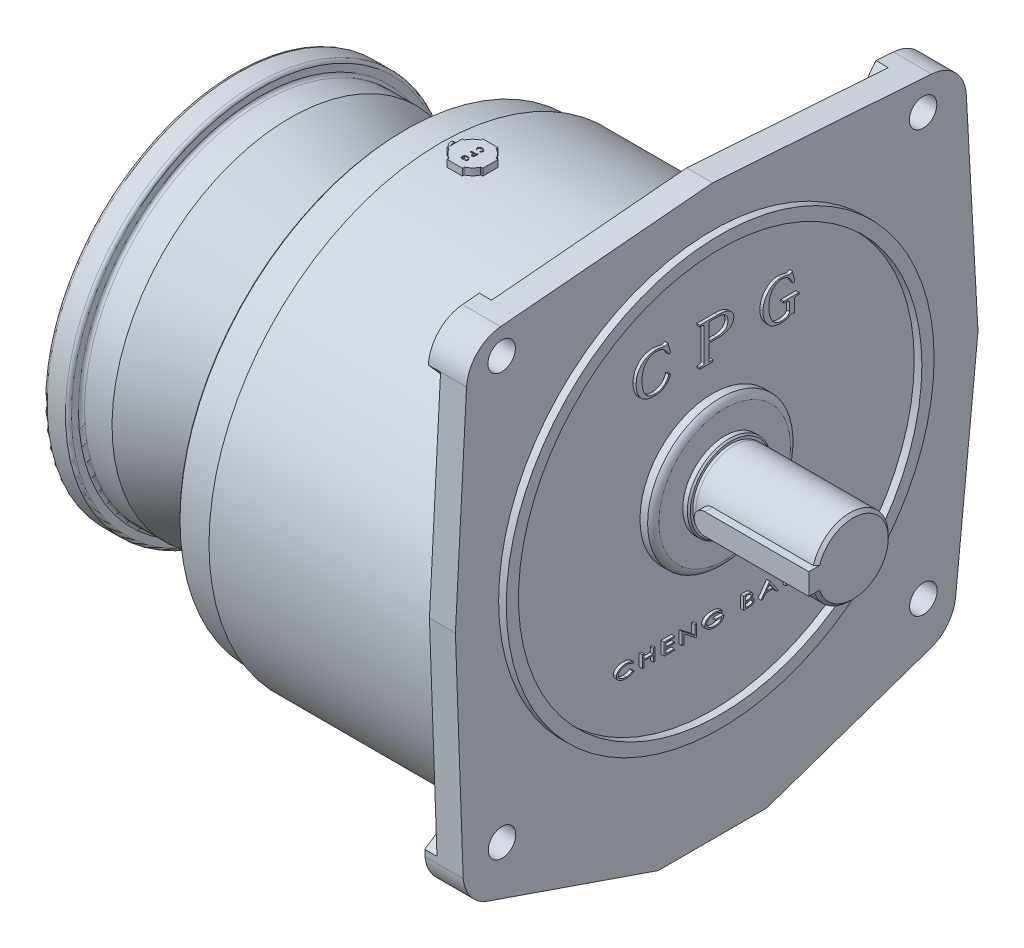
SolidWorks part; units mm, degrees
ref_plane "前基準面" through (0, 0, 0) normal (0, 0, 1) x (1, 0, 0)
ref_plane "上基準面" through (0, 0, 0) normal (0, 1, 0) x (1, 0, 0)
ref_plane "右基準面" through (0, 0, 0) normal (1, 0, 0) x (0, 0, -1)
sketch "草圖2" plane through (0, 0, 0) normal (0, 0, 1) x (1, 0, 0)
  line L0 (-161, 151.5439) -> (0, 151.5439)
  line L1 (-161, 151.5439) -> (-161, 146.5067)
  line L2 (-190.5, 0) -> (0, 0)
  line L3 (0, 0) -> (0, 151.5439)
  line L4 (-162, 147.5067) -> (-161, 146.5067)
  line L5 (-185, 146.5067) -> (-185, 124.0067)
  line L6 (-189, 123.0067) -> (-189, 105.0067)
  line L7 (-190.5, 104.0067) -> (-190.5, 0)
  line L9 (-189, 105.0067) -> (-189.5, 105.0067)
  line L10 (-189.5, 105.0067) -> (-190.5, 104.0067)
  line L12 (-188, 124.0067) -> (-189, 123.0067)
  line L13 (-185, 124.0067) -> (-188, 124.0067)
  line L14 (-184, 147.5067) -> (-185, 146.5067)
  line L15 (-162, 147.5067) -> (-184, 147.5067)
  line L23 (-511.9929, 0) -> (96.9678, 0) construction
  dimension "D4" = 161
revolve "旋轉1" add sketch "草圖2" angle 360 about L23
sketch "草圖5" plane through (0, 0, 0) normal (1, 0, 0) x (0, 0, -1)
  line L0 (-260.2741, 51) -> (337.3159, 51) construction
  line L1 (166.0988, 184.8249) -> (173.7337, 46.8699)
  line L2 (-168.2663, 46.8699) -> (-163.1792, -94.766)
  line L3 (173.7337, 46.8699) -> (159.0195, -97.1828)
  line L4 (0, 0) -> (0, -245.4677) construction
  line L5 (0, 217.8699) -> (-138.6589, 205.7388)
  line L6 (-168.2663, 46.8699) -> (-160.9885, 182.6434)
  line L7 (0, 51) -> (-138, 188.7716) construction
  line L8 (0, 217.8699) -> (143.3342, 207.9121)
  line L9 (-286.7543, 0) -> (309.9532, 0) construction
  line L10 (0, 251.9137) -> (0, 51) construction
  line L14 (35.5, -154.1301) -> (-35.5, -154.1301)
  line L15 (-146.7463, -115.8249) -> (-35.5, -154.1301)
  line L16 (142.6964, -117.2194) -> (35.5, -154.1301)
  circle A0 centre (-138, 188.7716) radius 9
  circle A1 centre (0, 51) radius 195 construction
  circle A2 centre (137.7716, 189) radius 9
  circle A3 centre (138, -86.7716) radius 9
  circle A4 centre (-137.7716, -87) radius 9
  arc A5 (-138.6589, 205.7388) -> (-160.9885, 182.6434) centre (-136.5236, 181.332) ccw
  arc A6 (-163.1792, -94.766) -> (-146.7463, -115.8249) centre (-138.7699, -92.6597) ccw
  arc A7 (159.0195, -97.1828) -> (142.6964, -117.2194) centre (134.72, -94.0542) cw
  arc A8 (143.3342, 207.9121) -> (166.0988, 184.8249) centre (141.6362, 183.471) cw
  dimension "D4" = 18
  dimension "D5" = 24.5
  dimension "D3" = 390
  dimension "D2" = 342
  dimension "D9" = 372
  dimension "D11" = 138
extrude "伸長1" add sketch "草圖5" along normal blind 17
sketch "草圖6" plane through (17, 0, 0) normal (1, 0, 0) x (0, 0, -1)
  circle A0 centre (0, 51) radius 140
  circle A1 centre (0, 51) radius 132
  dimension "D1" = 280
  dimension "D2" = 264
extrude "伸長2" add sketch "草圖6" along normal blind 5
sketch "草圖7" plane through (0, 0, 0) normal (0, 0, 1) x (1, 0, 0)
  line L0 (109, 51) -> (130.8468, 51) construction
  line L1 (31, 76) -> (106.985, 76)
  line L2 (106.985, 76) -> (31, 76)
  line L3 (22, 98.5) -> (17, 98.5)
  line L4 (29, 75.9) -> (29, 77.5)
  line L5 (31, 75.9) -> (31, 76)
  line L6 (24.985, 94.0279) -> (24.985, 78.5)
  line L7 (29, 75.9) -> (31, 75.9)
  line L8 (31, 75.9) -> (29, 75.9)
  line L9 (29, 77.5) -> (29, 75.9)
  line L10 (28, 78.5) -> (29, 77.5)
  line L11 (24.985, 78.5) -> (28, 78.5)
  line L12 (29, 77.5) -> (28, 78.5)
  line L13 (28, 78.5) -> (24.985, 78.5)
  line L14 (31, 75.9) -> (31, 76)
  line L15 (109, 51) -> (109, 74)
  line L16 (106.985, 76) -> (109, 74)
  line L17 (109, 74) -> (106.985, 76)
  line L18 (17, 46.8699) -> (17, 182.6434) construction
  line L20 (17, 98.5) -> (17, 51)
  line L22 (17, 51) -> (109, 51)
  line L23 (17, 217.8699) -> (17, 207.9121) construction
  arc A0 (24.985, 94.0279) -> (22, 98.5) centre (17.9603, 92.5714) ccw
  dimension "D1" = 50
  dimension "D2" = 80
  dimension "D3" = 92
  dimension "D4" = 55
revolve "旋轉2" add sketch "草圖7" angle 360 about L0
sketch "草圖12"
extrude "伸長7" add sketch "草圖12" along normal blind 2
sketch "草圖13" plane through (0, 0, 0) normal (-1, 0, 0) x (0, 0, 1)
  line L0 (-166.0988, 184.8249) -> (-101.3929, 112.628)
  line L1 (-131.988, 208.7004) -> (-71.876, 133.4144)
  line L2 (0, 217.8699) -> (-143.3342, 207.9121) construction
  line L3 (160.9885, 182.6434) -> (100.3002, 113.6021)
  line L4 (127.6635, 206.7008) -> (69.5334, 134.6502)
  line L5 (0, 217.8699) -> (138.6589, 205.7388) construction
  line L6 (-142.6964, -117.2194) -> (-117.0566, -96.2461)
  line L7 (-160.0698, -86.8998) -> (-135.1585, -68.5401)
  line L8 (-173.7337, 46.8699) -> (-159.0195, -97.1828) construction
  line L9 (146.7463, -115.8249) -> (117.0566, -96.2461)
  line L10 (163.3273, -90.6426) -> (134.0214, -70.7377)
  line L12 (168.2663, 46.8699) -> (163.1792, -94.766) construction
  line L13 (163.3273, -90.6426) -> (163.1792, -94.766)
  line L14 (-160.0698, -86.8998) -> (-159.0195, -97.1828)
  line L15 (-131.988, 208.7004) -> (-143.3342, 207.9121)
  line L16 (127.6635, 206.7008) -> (138.6589, 205.7388)
  circle A0 centre (0, 0) radius 151.5439 construction
  circle A1 centre (0, 0) radius 151.5439 construction
  arc A2 (146.7463, -115.8249) -> (163.1792, -94.766) centre (138.7699, -92.6597) ccw construction
  arc A3 (-159.0195, -97.1828) -> (-142.6964, -117.2194) centre (-134.72, -94.0542) ccw construction
  arc A4 (146.7463, -115.8249) -> (163.1792, -94.766) centre (138.7699, -92.6597) ccw
  arc A5 (-159.0195, -97.1828) -> (-142.6964, -117.2194) centre (-134.72, -94.0542) ccw
  arc A6 (-143.3342, 207.9121) -> (-166.0988, 184.8249) centre (-141.6362, 183.471) ccw construction
  arc A7 (160.9885, 182.6434) -> (138.6589, 205.7388) centre (136.5236, 181.332) ccw construction
  arc A8 (-143.3342, 207.9121) -> (-166.0988, 184.8249) centre (-141.6362, 183.471) ccw
  arc A9 (160.9885, 182.6434) -> (138.6589, 205.7388) centre (136.5236, 181.332) ccw
  arc A10 (117.0566, -96.2461) -> (134.0214, -70.7377) centre (0, 0) ccw
  arc A11 (100.3002, 113.6021) -> (69.5334, 134.6502) centre (0, 0) ccw
  arc A12 (-71.876, 133.4144) -> (-101.3929, 112.628) centre (0, 0) ccw
  arc A13 (-135.1585, -68.5401) -> (-117.0566, -96.2461) centre (0, 0) ccw
  circle A17 centre (-137.7716, 189) radius 9 construction
  circle A18 centre (-137.7716, 189) radius 9
  circle A19 centre (138, 188.7716) radius 9 construction
  circle A21 centre (138, 188.7716) radius 9
  circle A22 centre (-138, -86.7716) radius 9 construction
  circle A23 centre (-138, -86.7716) radius 9
  circle A24 centre (137.7716, -87) radius 9 construction
  circle A25 centre (137.7716, -87) radius 9
extrude "伸長13" add sketch "草圖13" along normal blind 8
sketch "草圖14" plane through (0, 0, 0) normal (0, 0, 1) x (1, 0, 0)
  line L0 (-277.5, -116.5) -> (-259.5, -116.5)
  line L1 (-192.5, -91) -> (-205, -91)
  line L2 (-205.5, -91) -> (-259.5, -116.5)
  line L3 (-283, -32.5) -> (-284.5, -32.5)
  line L4 (-321.5954, 0) -> (-95.099, 0) construction
  line L5 (-205, -91) -> (-205.5, -91)
  line L6 (-190.5, 0) -> (-283, 0)
  line L7 (109, 28) -> (109, 74) construction
  line L8 (-190.5, -89) -> (-190.5, 0)
  line L14 (-284.5, -49.0465) -> (-284.5, -32.5)
  line L15 (-245.1, -59.9307) -> (-282.9286, -51)
  line L16 (-290.5, -90) -> (-290.5, -78)
  line L18 (-279.5, -123) -> (-279.5, -118.5)
  line L19 (-293.5, -125) -> (-281.5, -125)
  line L20 (-295.5, -123) -> (-295.5, -90)
  line L21 (-245.1, -71.9894) -> (-245.1, -59.9307)
  line L22 (-290.5, -78) -> (-251.1, -78)
  line L23 (-295.5, -90) -> (-290.5, -90)
  line L24 (-283, -32.5) -> (-283, 0)
  arc A7 (-245.1, -71.9894) -> (-251.1, -78) centre (-251.1, -72) cw
  arc A8 (-190.5, -89) -> (-192.5, -91) centre (-192.5, -89) cw
  arc A9 (-279.5, -118.5) -> (-277.5, -116.5) centre (-277.5, -118.5) cw
  arc A10 (-279.5, -123) -> (-281.5, -125) centre (-281.5, -123) cw
  arc A11 (-293.5, -125) -> (-295.5, -123) centre (-293.5, -123) cw
  arc A13 (-282.9286, -51) -> (-284.5, -49.0465) centre (-282.5, -49.0465) cw
  dimension "D1" = 250
  dimension "D2" = 180
  dimension "D3" = 299.5
  dimension "D4" = 404.5
  dimension "D9" = 105
  dimension "D14" = 51
revolve "旋轉3" add sketch "草圖14" angle 360 about L4
sketch "草圖15" plane through (-295.5, 0, 0) normal (-1, 0, 0) x (0, 0, 1)
  circle A0 centre (0, 0) radius 107.5 construction
  circle A1 centre (-76.014, 76.014) radius 6
  circle A2 centre (76.014, 76.014) radius 6
  circle A3 centre (76.014, -76.014) radius 6
  circle A4 centre (-76.014, -76.014) radius 6
  dimension "D1" = 215
  dimension "D2" = 12
extrude "伸長14" cut sketch "草圖15" against normal blind 30
sketch "草圖16" plane through (-295.5, 0, 0) normal (-1, 0, 0) x (0, 0, 1)
  line L3 (-88.9775, 50.7937) -> (-60.901, 22.7172)
  line L6 (50.7937, 88.9775) -> (22.7172, 60.901)
  line L8 (88.9775, -50.7937) -> (60.901, -22.7172)
  line L11 (-50.7937, -88.9775) -> (-22.7172, -60.901)
  line L13 (-60.901, -22.7172) -> (-88.9775, -50.7937)
  line L16 (-67.8928, -38.7361) -> (-58.167, -29.0104)
  line L18 (41.2181, -70.3748) -> (29.0104, -58.167)
  line L24 (70.3748, -41.2181) -> (58.5646, -28.1991)
  line L36 (41.2181, 70.3748) -> (29.0104, 58.167)
  line L37 (-70.3748, 41.2181) -> (-58.167, 29.0104)
  line L38 (22.7172, -60.901) -> (50.7937, -88.9775)
  line L39 (60.901, 22.7172) -> (88.9775, 50.7937)
  line L40 (-29.0206, 58.1619) -> (-39.7711, 68.9869)
  line L41 (-38.7361, -67.8928) -> (-29.0104, -58.167)
  line L42 (-22.7172, 60.901) -> (-50.7937, 88.9775)
  line L43 (70.3748, 41.2181) -> (58.167, 29.0104)
  arc A13 (75.6403, 48.7703) -> (70.3748, 41.2181) centre (43.6427, 65.4682) cw
  arc A14 (75.6403, 48.7703) -> (48.7703, 75.6403) centre (41.5234, 41.5234) ccw
  arc A15 (-88.9775, -50.7937) -> (-92.1469, -50.3383) centre (-90.3917, -49.3795) cw
  arc A16 (50.7937, 88.9775) -> (50.3383, 92.1469) centre (49.3795, 90.3917) ccw
  arc A17 (-48.7703, 75.6403) -> (-39.7711, 68.9869) centre (-65.4682, 43.6427) cw
  arc A20 (-75.6403, -48.7703) -> (-48.7703, -75.6403) centre (-41.5234, -41.5234) ccw
  arc A23 (75.6403, -48.7703) -> (70.3748, -41.2181) centre (43.6427, -65.4682) ccw
  arc A27 (-48.7703, -75.6403) -> (-38.7361, -67.8928) centre (-65.4682, -43.6427) ccw
  arc A30 (50.7937, -88.9775) -> (50.3383, -92.1469) centre (49.3795, -90.3917) cw
  arc A33 (60.901, -22.7172) -> (60.901, 22.7172) centre (0, 0) ccw
  arc A37 (-75.6403, 48.7703) -> (-70.3748, 41.2181) centre (-43.6427, 65.4682) ccw
  arc A40 (-60.901, 22.7172) -> (-60.901, -22.7172) centre (0, 0) ccw
  arc A72 (22.7172, 60.901) -> (-22.7172, 60.901) centre (0, 0) ccw
  arc A73 (88.9775, 50.7937) -> (92.1469, 50.3383) centre (90.3917, 49.3795) cw
  arc A74 (48.7703, -75.6403) -> (75.6403, -48.7703) centre (41.5234, -41.5234) ccw
  arc A75 (-22.7172, -60.901) -> (22.7172, -60.901) centre (0, 0) ccw
  arc A76 (92.1469, -50.3383) -> (92.1469, 50.3383) centre (0, 0) ccw
  arc A77 (48.7703, -75.6403) -> (41.2181, -70.3748) centre (65.4682, -43.6427) cw
  arc A78 (-29.0206, 58.1619) -> (-58.167, 29.0104) centre (0, 0) ccw
  arc A79 (50.3383, 92.1469) -> (-50.3383, 92.1469) centre (0, 0) ccw
  arc A80 (-88.9775, 50.7937) -> (-92.1469, 50.3383) centre (-90.3917, 49.3795) ccw
  arc A81 (-75.6403, -48.7703) -> (-67.8928, -38.7361) centre (-43.6427, -65.4682) cw
  arc A82 (29.0104, -58.167) -> (58.5646, -28.1991) centre (0, 0) ccw
  arc A83 (-58.167, -29.0104) -> (-29.0104, -58.167) centre (0, 0) ccw
  arc A84 (48.7703, 75.6403) -> (41.2181, 70.3748) centre (65.4682, 43.6427) ccw
  arc A85 (58.167, 29.0104) -> (29.0104, 58.167) centre (0, 0) ccw
  arc A86 (88.9775, -50.7937) -> (92.1469, -50.3383) centre (90.3917, -49.3795) ccw
  arc A87 (-48.7703, 75.6403) -> (-75.6403, 48.7703) centre (-41.5234, 41.5234) ccw
  arc A88 (-50.7937, 88.9775) -> (-50.3383, 92.1469) centre (-49.3795, 90.3917) cw
  arc A89 (-92.1469, 50.3383) -> (-92.1469, -50.3383) centre (0, 0) ccw
  arc A90 (-50.3383, -92.1469) -> (50.3383, -92.1469) centre (0, 0) ccw
  arc A91 (-50.7937, -88.9775) -> (-50.3383, -92.1469) centre (-49.3795, -90.3917) ccw
  dimension "D1" = 130
extrude "伸長15" cut sketch "草圖16" against normal blind 53
sketch "草圖17" plane through (-242.5, 0, 0) normal (-1, 0, 0) x (0, 0, 1)
  circle A0 centre (0, 0) radius 75 construction
  circle A1 centre (0, 75) radius 4.5
  circle A4 centre (53.033, 53.033) radius 4.5
  circle A5 centre (75, 0) radius 4.5
  circle A6 centre (53.033, -53.033) radius 4.5
  circle A7 centre (0, -75) radius 4.5
  circle A8 centre (-53.033, -53.033) radius 4.5
  circle A9 centre (-75, 0) radius 4.5
  circle A10 centre (-53.033, 53.033) radius 4.5
  dimension "D1" = 150
  dimension "D2" = 9
extrude "伸長16" cut sketch "草圖17" against normal blind 11
sketch "草圖18" plane through (-283, 0, 0) normal (-1, 0, 0) x (0, 0, 1)
  line L1 (4.6667, 13.1993) -> (4.6667, 17.2667)
  line L2 (0, -27.1353) -> (0, 27.1353) construction
  line L3 (-4.6667, 13.1993) -> (-4.6667, 17.2667)
  line L4 (-27.1353, 0) -> (27.1353, 0) construction
  line L5 (4.6667, 17.2667) -> (-4.6667, 17.2667)
  circle A0 centre (0, 0) radius 23.2167 construction
  arc A1 (-4.6667, 13.1993) -> (4.6667, 13.1993) centre (0, 0) ccw
extrude "伸長17" cut sketch "草圖18" against normal blind 58
sketch "草圖19" plane through (-284.5, 0, 0) normal (-1, 0, 0) x (0, 0, 1)
  line L0 (-4.6667, 13.1993) -> (-4.6667, 17.2667) construction
  line L1 (4.6667, 17.2667) -> (-4.6667, 17.2667) construction
  line L2 (4.6667, 13.1993) -> (4.6667, 17.2667) construction
  line L3 (-4.6667, 13.1993) -> (-4.6667, 17.2667)
  line L4 (4.6667, 17.2667) -> (-4.6667, 17.2667)
  line L5 (4.6667, 13.1993) -> (4.6667, 17.2667)
  circle A0 centre (0, 0) radius 23.2167 construction
  circle A1 centre (0, 0) radius 23.2167
  arc A2 (-4.6667, 13.1993) -> (4.6667, 13.1993) centre (0, 0) ccw construction
  arc A3 (-4.6667, 13.1993) -> (4.6667, 13.1993) centre (0, 0) ccw
extrude "伸長18" add sketch "草圖19" along normal blind 1 separate body
ref_plane "平面1" through (0, 51, 0) normal (0, 1, 0) x (-1, 0, 0)
sketch "草圖20" plane through (0, 0, 0) normal (0, 0, 1) x (1, 0, 0)
  line L0 (171.0114, 51) -> (-13.654, 51) construction
  line L1 (109, 58) -> (41, 58)
  line L2 (109, 28) -> (109, 74) construction
  line L3 (41, 44) -> (109, 44)
  line L4 (109, 44) -> (109, 58)
  line L5 (34, 51) -> (34, 89.955) construction
  line L6 (163, 51) -> (163, 95.2574) construction
  arc A0 (41, 58) -> (41, 44) centre (41, 51) ccw
  dimension "D1" = 25
  dimension "D2" = 14
  dimension "D3" = 7
  dimension "D4" = 75
  dimension "D5" = 54
extrude "伸長19" add sketch "草圖20" along normal blind 29
ref_plane "平面2" through (0, 0, 0) normal (0, 0.5736, 0.8192) x (1, 0, 0)
sketch "草圖21" plane through (0, 0, 0) normal (0, 0.5736, 0.8192) x (1, 0, 0)
  line L1 (-8, 150.5131) -> (-8, 246.6625) construction
  line L2 (-8, 151.5439) -> (-161, 151.5439) construction
  arc A0 (-8, 198.5878) -> (-54.8138, 151.5439) centre (-83.0054, 226.4121) cw
  dimension "D1" = 80
rib "肋材1" sketch "草圖21" sketch "草圖21" thickness 10 extrusion direction parallel to sketch draft on no parameters "D1"=10
pattern_circular "環狀複製排列1" count 2 over 70 about axis through (0, 0, 0) along (1, 0, 0) of "肋材1"
ref_plane "平面3" through (0, 156, 0) normal (0, 1, 0) x (-1, 0, 0)
sketch "草圖22" plane through (0, 156, 0) normal (0, 1, 0) x (-1, 0, 0)
  line L0 (135, 11.65) -> (145, 11.65)
  line L1 (135, 11.65) -> (135, 10.5119)
  line L2 (145, 11.65) -> (145, 10.5119)
  line L3 (135, -10.5119) -> (135, -11.65)
  line L4 (145, -10.5119) -> (145, -11.65)
  line L5 (128.35, 5) -> (129.4881, 5)
  line L6 (128.35, -5) -> (129.4881, -5)
  line L7 (128.35, -5) -> (128.35, 5)
  line L8 (135, -11.65) -> (135, -10.5119)
  line L9 (145, -11.65) -> (145, -10.5119)
  line L10 (145, -11.65) -> (135, -11.65)
  line L11 (151.65, -5) -> (150.5119, -5)
  line L12 (151.65, 5) -> (150.5119, 5)
  line L13 (151.65, 5) -> (151.65, -5)
  arc A0 (134.8617, 10.2882) -> (129.7118, 5.1383) centre (140, 0) ccw
  arc A1 (134.8617, 10.2882) -> (135, 10.5119) centre (134.75, 10.5119) ccw
  arc A2 (145, 10.5119) -> (145.1383, 10.2882) centre (145.25, 10.5119) ccw
  arc A3 (129.4881, 5) -> (129.7118, 5.1383) centre (129.4881, 5.25) ccw
  arc A4 (129.7118, -5.1383) -> (129.4881, -5) centre (129.4881, -5.25) ccw
  arc A5 (135, -10.5119) -> (134.8617, -10.2882) centre (134.75, -10.5119) ccw
  arc A6 (145.1383, -10.2882) -> (145, -10.5119) centre (145.25, -10.5119) ccw
  arc A7 (150.5119, -5) -> (150.2882, -5.1383) centre (150.5119, -5.25) ccw
  arc A8 (150.2882, 5.1383) -> (150.5119, 5) centre (150.5119, 5.25) ccw
  arc A9 (150.2882, 5.1383) -> (145.1383, 10.2882) centre (140, 0) ccw
  arc A10 (129.7118, -5.1383) -> (134.8617, -10.2882) centre (140, 0) ccw
  arc A11 (145.1383, -10.2882) -> (150.2882, -5.1383) centre (140, 0) ccw
extrude "伸長20" add sketch "草圖22" against normal blind 4.5 contours A6 A11 A7 L11 L13 L12 A8 A9 A2 L2 L0 L1 A1 A0 A3 L5 L7 L6 A4 A10 A5 L3 L10 L4
sketch "草圖23"
extrude "伸長21" add sketch "草圖23" along normal blind 0.5
sketch "草圖24" plane through (0, 0, 0) normal (0, 0, 1) x (1, 0, 0)
  line L0 (-154.15, 153.75) -> (-146.15, 153.75)
  line L1 (-154.15, 153.75) -> (-154.15, 155.75)
  line L2 (-152.65, 155) -> (-152.65, 155.75)
  line L13 (-150.65, 155) -> (-146.15, 154.75)
  line L15 (-152.65, 155) -> (-150.65, 155)
  line L23 (-154.15, 155.75) -> (-152.65, 155.75)
  line L24 (-150.65, 153.75) -> (-150.65, 155)
  line L25 (-146.15, 153.75) -> (-146.15, 154.75)
revolve "旋轉4" add sketch "草圖24" angle 360 about L0
equation "\"D4@草圖7\" = \"D1@草圖7\"+5"
equation "\"D1@伸長19\" = \"D5@草圖20\"-\"D1@草圖7\"/2"
equation "\"D9@草圖14\" = \"D4@草圖14\"-\"D3@草圖14\""
equation "\"D1@草圖6\" =\"D2@草圖6\"+16"
